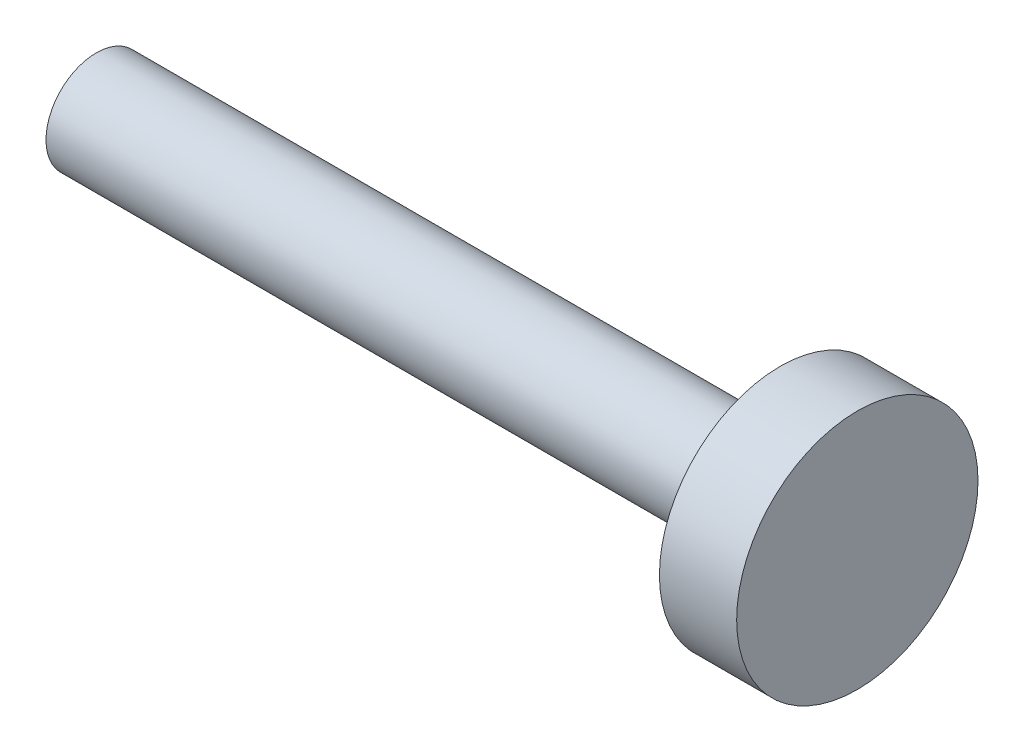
SolidWorks part; units mm, degrees
ref_plane "Front Plane" through (0, 0, 0) normal (0, 0, 1) x (1, 0, 0)
ref_plane "Top Plane" through (0, 0, 0) normal (0, 1, 0) x (1, 0, 0)
ref_plane "Right Plane" through (0, 0, 0) normal (1, 0, 0) x (0, 0, -1)
sketch "Sketch1" plane through (0, 0, 0) normal (0, 0, 1) x (1, 0, 0)
  line L0 (0, 0) -> (0, 1.5875)
  line L1 (0, 1.5875) -> (21.59, 1.5875)
  line L2 (21.59, 1.5875) -> (21.59, 3.81)
  line L3 (21.59, 3.81) -> (24.0284, 3.81)
  line L4 (24.0284, 3.81) -> (24.0284, 0)
  line L5 (24.0284, 0) -> (0, 0)
  line L6 (24.0284, 0) -> (0, 0) construction
revolve "Revolve1" add sketch "Sketch1" angle 360 about L6
